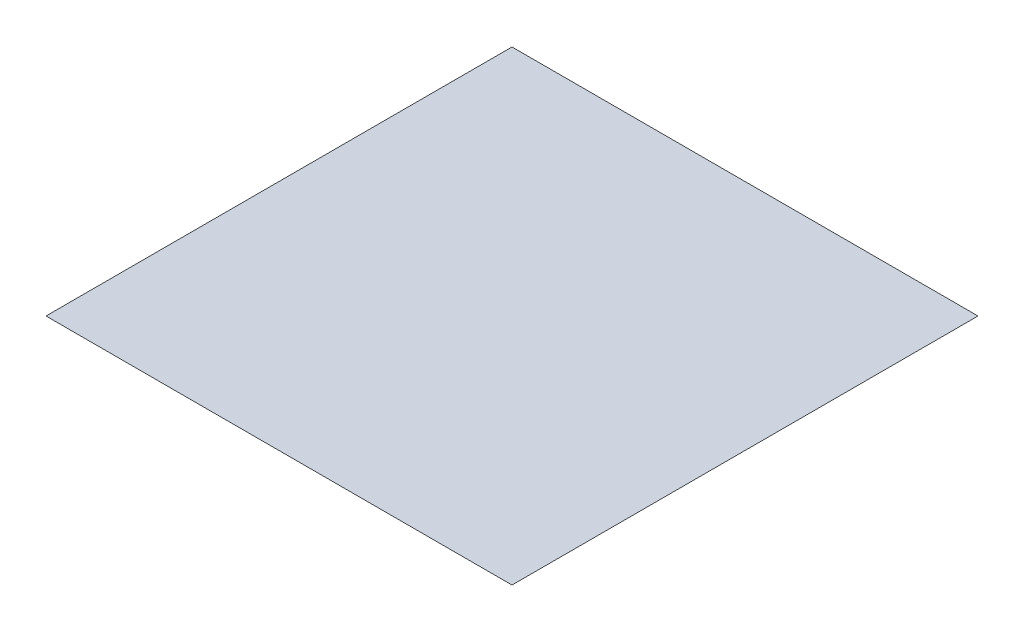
SolidWorks part; units mm, degrees
ref_plane "Plane1" through (0, 0, 0) normal (0, 0, 1) x (1, 0, 0)
ref_plane "Plane2" through (0, 0, 0) normal (0, 1, 0) x (1, 0, 0)
ref_plane "Plane3" through (0, 0, 0) normal (1, 0, 0) x (0, 0, -1)
sketch "Sketch1" plane through (0, 0, 0) normal (0, 0, 1) x (1, 0, 0)
  line L0 (-25, 0) -> (25, 0)
  dimension "D1" = 50
surface "Surface-Extrude1" sketch "Sketch1" parameters "D1"=50
